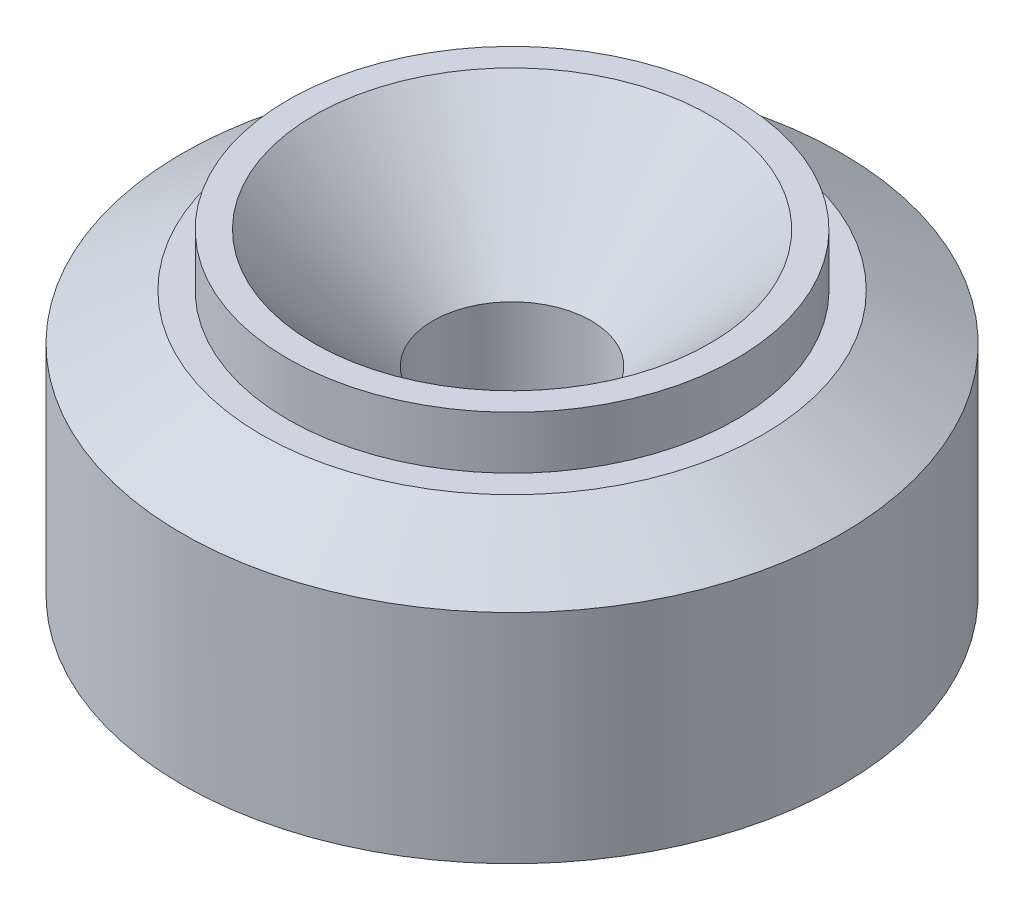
SolidWorks part; units mm, degrees
ref_plane "Přední rovina" through (0, 0, 0) normal (0, 0, 1) x (1, 0, 0)
ref_plane "Horní rovina" through (0, 0, 0) normal (0, 1, 0) x (1, 0, 0)
ref_plane "Pravá rovina" through (0, 0, 0) normal (1, 0, 0) x (0, 0, -1)
sketch "Skica1" plane through (0, 0, 0) normal (0, 1, 0) x (1, 0, 0)
  circle A0 centre (0, 0) radius 12.5
  dimension "D1" = 25
extrude "Přidat vysunutím1" add sketch "Skica1" along normal blind 12
sketch "Skica2" plane through (0, 0, 0) normal (0, -1, 0) x (1, 0, 0)
  circle A0 centre (0, 0) radius 7
  dimension "D1" = 14
extrude "Odebrat vysunutím1" cut sketch "Skica2" against normal blind 2
sketch "Skica3" plane through (0, 2, 0) normal (0, -1, 0) x (1, 0, 0)
  circle A0 centre (0, 0) radius 3
  dimension "D1" = 6
extrude "Odebrat vysunutím2" cut sketch "Skica3" against normal blind 5.5
sketch "Skica4" plane through (0, 12, 0) normal (0, 1, 0) x (-1, 0, 0)
  circle A0 centre (0, 0) radius 7.5
  dimension "D1" = 15
extrude "Odebrat vysunutím3" cut sketch "Skica4" against normal blind 4.5 draft 45
sketch "Skica5" plane through (0, 12, 0) normal (0, 1, 0) x (-1, 0, 0)
  circle A0 centre (0, 0) radius 8.5
  dimension "D1" = 17
extrude "Odebrat vysunutím4" cut sketch "Skica5" against normal blind 2 flip side to cut
chamfer "Zkosení1" distance 1.75 distance2 3 1 edges at (0, 10, 12.5)
